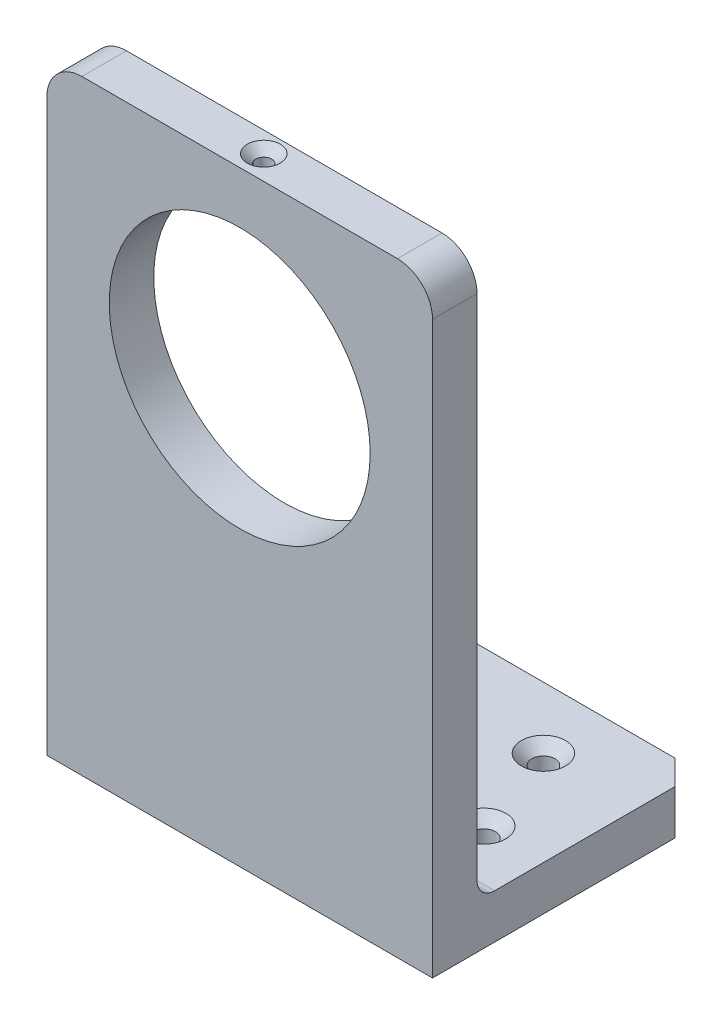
SolidWorks part; units mm, degrees
ref_plane "Front Plane" through (0, 0, 0) normal (0, 0, 1) x (1, 0, 0)
ref_plane "Top Plane" through (0, 0, 0) normal (0, 1, 0) x (1, 0, 0)
ref_plane "Right Plane" through (0, 0, 0) normal (1, 0, 0) x (0, 0, -1)
sketch "Sketch1" plane through (0, 0, 0) normal (0, 0, 1) x (1, 0, 0)
  line L0 (0, 0) -> (0, 51.8704) construction
  line L1 (55, 160) -> (-55, 160)
  line L2 (-55, 160) -> (-55, 0)
  line L3 (-55, 0) -> (55, 0)
  line L4 (55, 160) -> (55, 0)
  circle A0 centre (0, 108) radius 37.211
  point P8 (0, 160)
  dimension "D1" = 74.422
  dimension "D2" = 110
  dimension "D3" = 160
  dimension "D4" = 52
extrude "Extrude1" add sketch "Sketch1" along normal blind 12.7
sketch "Sketch2" plane through (0, 0, 12.7) normal (0, 0, 1) x (1, 0, 0)
  line L0 (-55, 0) -> (55, 0) construction
  line L1 (-55, 0) -> (55, 0)
  line L2 (-55, -12.7) -> (55, -12.7)
  line L3 (-55, 0) -> (-55, -12.7)
  line L4 (55, 0) -> (55, -12.7)
  dimension "D1" = 12.7
extrude "Extrude3" add sketch "Sketch2" against normal blind 76.2
hole_wizard "CSK for M6 Flat Head Machine Screw1" positions "3DSketch1" profile "Sketch4" countersink size "M6" standard "Ansi Metric"
sketch3d "3DSketch1"
  line L0 (-55, 0, -63.5) -> (-55, 0, 0) construction
  line L1 (55, 0, -63.5) -> (55, 0, 0) construction
  point P0 (-30, 0, -45.9319)
  point P2 (28, 0, -45.9319)
  point P4 (37.5, 0, -19.4326)
  point P6 (-37.5, 0, -19.4326)
  dimension "D1" = 25
  dimension "D2" = 27
sketch "Sketch4" plane through (-30, 0, -45.9319) normal (1, 0, 0) x (0, 0, 1)
  line L0 (0, 0) -> (0, 12.7)
  line L1 (0, 12.7) -> (3.3, 12.7)
  line L2 (3.3, 12.7) -> (3.3, 3)
  line L3 (3.3, 3) -> (6.3, 0)
  line L5 (6.3, 0) -> (0, 0)
  line L6 (-3.3, 3) -> (-6.3, 0) construction
  line L11 (0, -6.35) -> (0, 107.95) construction
  dimension "Thru Hole Dia." = 6.6
  dimension "Thru Hole Depth" = 12.7
  dimension "Near C'Sink Dia." = 12.6
  dimension "Near C'Sink Angle" = 90
sketch "Sketch5" plane through (0, 160, 0) normal (0, 1, 0) x (1, 0, 0)
  line L0 (0, 0) -> (0, -9.2918) construction
chamfer "Chamfer1" distance 7 angle 45 2 edges at (-55, -6.35, -63.5) (55, -6.35, -63.5)
fillet "Fillet1" radius 10 2 edges at (-55, 160, 6.35) (55, 160, 6.35)
fillet "Fillet2" radius 5 1 edges
hole_wizard "CSK for M4 Flat Head Machine Screw4" positions "3DSketch4" profile "Sketch10" countersink size "M4" standard "Ansi Metric"
sketch3d "3DSketch4"
  line L0 (0, 160, 0) -> (0, 160, 9.2918) construction
  point P0 (0, 160, 5.8342)
sketch "Sketch10" plane through (0, 160, 5.8342) normal (1, 0, 0) x (0, 0, 1)
  line L0 (0, 0) -> (0, 14.789)
  line L1 (0, 14.789) -> (2.25, 14.789)
  line L2 (2.25, 14.789) -> (2.25, 2.45)
  line L3 (2.25, 2.45) -> (4.7, 0)
  line L5 (4.7, 0) -> (0, 0)
  line L6 (-2.25, 2.45) -> (-4.7, 0) construction
  line L11 (0, -6.35) -> (0, 107.95) construction
  dimension "Thru Hole Dia." = 4.5
  dimension "Thru Hole Depth" = 14.789
  dimension "Near C'Sink Dia." = 9.4
  dimension "Near C'Sink Angle" = 90
